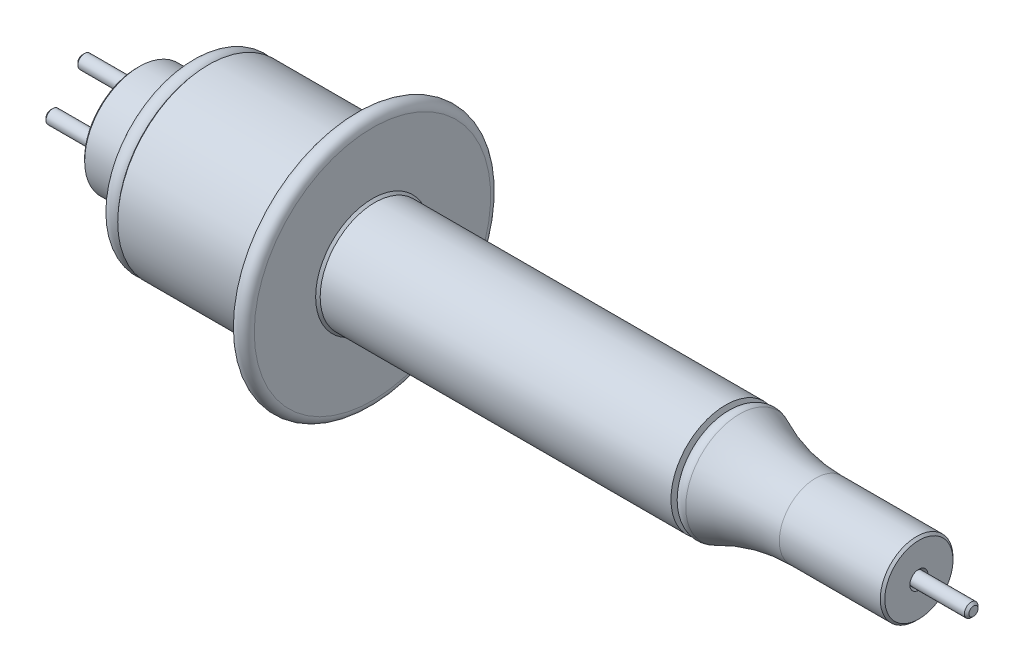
SolidWorks part; units mm, degrees
ref_plane "Спереди" through (0, 0, 0) normal (0, 0, 1) x (1, 0, 0)
ref_plane "Сверху" through (0, 0, 0) normal (0, 1, 0) x (1, 0, 0)
ref_plane "Справа" through (0, 0, 0) normal (1, 0, 0) x (0, 0, -1)
sketch "Эскиз1" plane through (0, 0, 0) normal (0, 0, 1) x (1, 0, 0)
  line L0 (0, 0) -> (86, 0) construction
  line L1 (0, 0) -> (80, 0)
  line L2 (80, 0) -> (80, 0.75)
  line L3 (80, 0.75) -> (86, 0.75)
  line L4 (86, 0.75) -> (86, 4)
  line L5 (86, 4) -> (74.65, 4)
  line L6 (25.9041, 6) -> (64.73, 6)
  line L7 (64.73, 6) -> (64.9227, 5.4206)
  line L8 (64.73, 6) -> (64.73, 0) construction
  line L9 (25.9041, 6) -> (25.9041, 13)
  line L10 (23.8468, 9.532) -> (24, 13.0415)
  line L11 (7.8875, 10) -> (22.1125, 10)
  line L12 (7.8875, 13) -> (22.1125, 13) construction
  line L13 (15, 13) -> (15, 10) construction
  line L14 (7.8875, 13) -> (7.8875, 10) construction
  line L15 (7.8875, 10) -> (7.6638, 9.7479)
  line L16 (22.1125, 10) -> (22.3362, 9.7479)
  line L17 (6, 9) -> (6, 6)
  line L18 (6, 6) -> (0, 6)
  line L19 (0, 6) -> (0, 0)
  arc A0 (66.2613, 5.9022) -> (64.9227, 5.4206) centre (65.83, 5) ccw
  arc A1 (66.2613, 5.9022) -> (74.65, 4) centre (74.65, 23.4481) ccw
  arc A2 (25.9041, 13) -> (24, 13.0415) centre (24.9516, 13) ccw
  arc A3 (7.6638, 9.7479) -> (6, 9) centre (7, 9) ccw
  arc A4 (23.8468, 9.532) -> (22.3362, 9.7479) centre (23, 9) ccw
  dimension "D4" = 2
  dimension "D6" = 1.905
  dimension "D13" = 2
  dimension "D1" = 1.5
  dimension "D2" = 6
  dimension "D3" = 8
  dimension "D5" = 20.17
  dimension "D7" = 11.35
  dimension "D8" = 12
  dimension "D9" = 18.4
  dimension "D10" = 1.1
  dimension "D11" = 26
  dimension "D12" = 2.5
  dimension "D14" = 20
  dimension "D15" = 14.225
  dimension "D16" = 8
  dimension "D17" = 17
  dimension "D18" = 6
  dimension "D19" = 80
revolve "Повернуть1" add sketch "Эскиз1" angle 360 about L0
chamfer "Фаска1" distance 0.25 angle 45 5 edges at (80, 0, 0.75) (86, 0, 0.75) (0, 0, 6) (25.9041, 0, 6) (86, 0, 4)
sketch "Эскиз2" plane through (80, 0, 0) normal (1, 0, 0) x (0, 0, -1)
  circle A0 centre (0, 0) radius 0.75 construction
  circle A1 centre (0, 0) radius 0.75
extrude "Бобышка-Вытянуть1" add sketch "Эскиз2" along normal blind 12 separate body
sketch "Эскиз3" plane through (0, 0, 0) normal (-1, 0, 0) x (0, 0, 1)
  circle A0 centre (0, 0) radius 3.5 construction
  circle A1 centre (0, 3.5) radius 0.75
  circle A2 centre (3.5, 0) radius 0.75
  circle A3 centre (0, -3.5) radius 0.75
  circle A4 centre (-3.5, 0) radius 0.75
  dimension "D1" = 7
  dimension "D2" = 1.5
  dimension "D3" = 4
extrude "Вырез-Вытянуть1" cut sketch "Эскиз3" against normal blind 6
chamfer "Фаска2" distance 0.25 angle 45 2 edges at (80, 0, -0.75) (92, 0, -0.75)
chamfer "Фаска3" distance 0.25 angle 45 8 edges at (0, 0, 4.25) (6, 0, 4.25) (0, -3.5, 0.75) (6, -3.5, 0.75) (0, 0, -2.75) (6, 0, -2.75) (0, 3.5, 0.75) (6, 3.5, 0.75)
sketch "Эскиз4" plane through (6, 0, 0) normal (-1, 0, 0) x (0, 0, 1)
  circle A1 centre (-3.5, 0) radius 0.75
  circle A2 centre (-3.5, 0) radius 0.75
  circle A3 centre (0, -3.5) radius 0.75
  circle A4 centre (0, -3.5) radius 0.75
  circle A5 centre (3.5, 0) radius 0.75
  circle A6 centre (3.5, 0) radius 0.75
  circle A7 centre (0, 3.5) radius 0.75
  circle A8 centre (0, 3.5) radius 0.75
  dimension "D1" = 0
  dimension "D2" = 0
  dimension "D3" = 0
  dimension "D4" = 0
extrude "Бобышка-Вытянуть2" add sketch "Эскиз4" along normal blind 12 separate body
chamfer "Фаска4" distance 0.25 angle 45 2 edges at (6, 3.5, 0.75) (-6, 3.5, 0.75)
chamfer "Фаска5" distance 0.25 angle 45 2 edges at (6, 0, -2.75) (-6, 0, -2.75)
chamfer "Фаска6" distance 0.25 angle 45 2 edges at (6, -3.5, 0.75) (-6, -3.5, 0.75)
chamfer "Фаска7" distance 0.25 angle 45 2 edges at (6, 0, 4.25) (-6, 0, 4.25)
